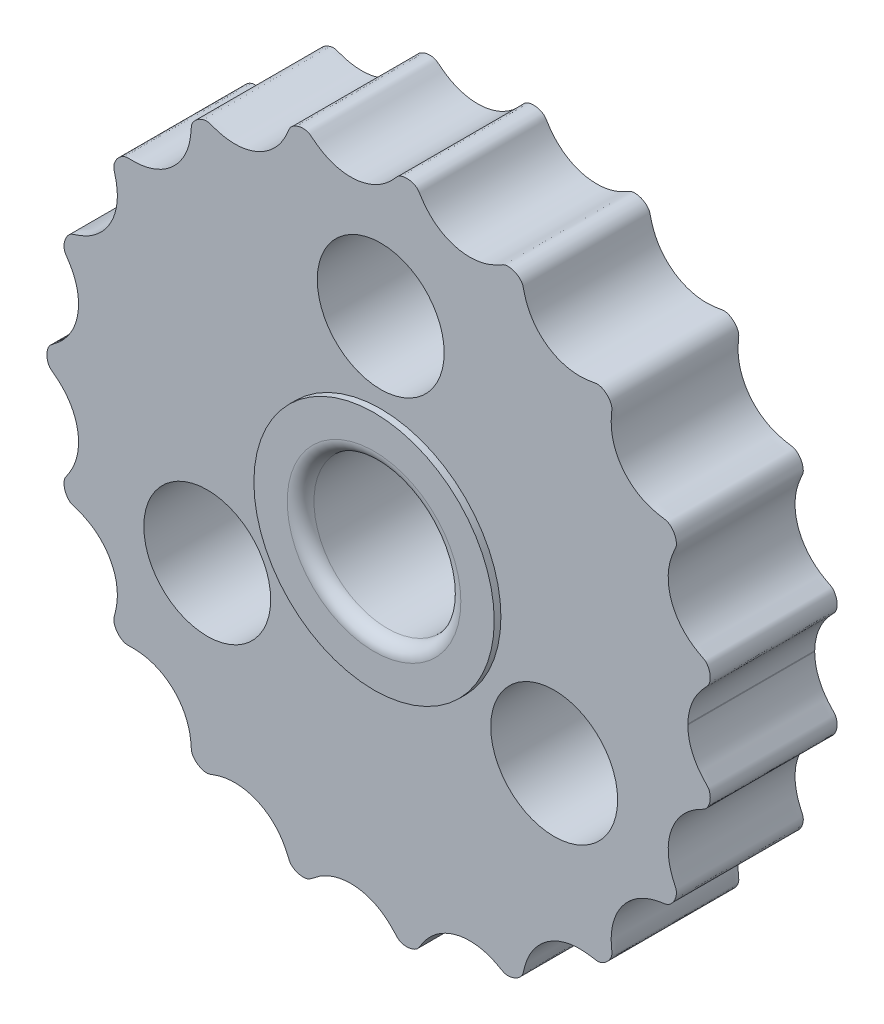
SolidWorks part; units mm, degrees
ref_plane "Ebene vorne" through (0, 0, 0) normal (0, 0, 1) x (1, 0, 0)
ref_plane "Ebene oben" through (0, 0, 0) normal (0, 1, 0) x (1, 0, 0)
ref_plane "Ebene rechts" through (0, 0, 0) normal (1, 0, 0) x (0, 0, -1)
sketch "Skizze1" plane through (0, 0, 0) normal (0, 0, 1) x (1, 0, 0)
  circle A0 centre (0, 0) radius 25
  dimension "D1" = 50
extrude "Aufsatz-Linear austragen1" add sketch "Skizze1" along normal blind 9.5 contours A0
sketch "Skizze3" plane through (0, 0, 9.5) normal (0, 0, 1) x (1, 0, 0)
  circle A0 centre (0, 25) radius 0.5
  circle A1 centre (0, 0) radius 25 construction
extrude "Schnitt-Linear austragen1" cut sketch "Skizze3" against normal up to next contours A0
pattern_circular "Kreismuster3" [suppressed] count 30 over 360
sketch "Skizze9" plane through (0, 0, 9.5) normal (0, 0, 1) x (1, 0, 0)
  line L0 (23.0004, 0.0609) -> (23, 0)
  spline S0 degree 4 number of poles 711 (21.8349, 10.4363) -> (21.8113, -10.3736) construction
  spline S1 degree 4 number of poles 634 (23, 0) -> (23.0004, 0.0609)
extrude "Schnitt-Linear austragen6" cut sketch "Skizze9" against normal blind 9.5 flip side to cut
sketch "Skizze23" plane through (0, 0, 9.5) normal (0, 0, 1) x (1, 0, 0)
  circle A0 centre (0, 0) radius 9
extrude "Aufsatz-Linear austragen2" add sketch "Skizze23" along normal blind 0.5
sketch "Skizze21" plane through (0, 0, 0) normal (0, 0, -1) x (-1, 0, 0)
  circle A0 centre (0, 0) radius 5.5
  dimension "D1" = 11
extrude "Schnitt-Linear austragen11" cut sketch "Skizze21" against normal blind 10
sketch "Skizze22" plane through (0, 0, 0) normal (0, 0, -1) x (-1, 0, 0)
  circle A0 centre (0, 0) radius 15
  circle A1 centre (0, 15) radius 4.75
  circle A2 centre (12.9904, -7.5) radius 4.75
  circle A3 centre (-12.9904, -7.5) radius 4.75
  point P12 (0, 0)
  dimension "D1" = 3
  dimension "D2" = 9.5
fillet "Verrundung1" radius 1 2 edges at (-5.5, 0, 0) (-5.5, 0, 10)
extrude "Schnitt-Linear austragen12" cut sketch "Skizze22" against normal blind 10 contours A1 | A2 | A3
